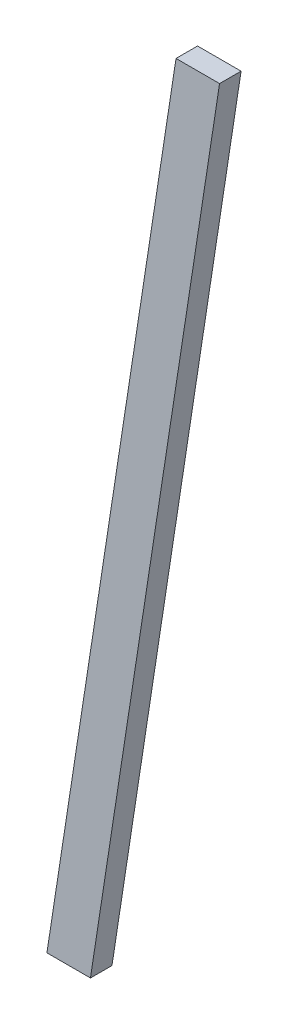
SolidWorks part; units mm, degrees
ref_plane "Front Plane" through (0, 0, 0) normal (0, 0, 1) x (1, 0, 0)
ref_plane "Top Plane" through (0, 0, 0) normal (0, 1, 0) x (1, 0, 0)
ref_plane "Right Plane" through (0, 0, 0) normal (1, 0, 0) x (0, 0, -1)
sketch "Sketch1" plane through (0, 0, 0) normal (0, 0, 1) x (1, 0, 0)
  line L0 (-1219.2, 0) -> (1219.2, 0) construction
  line L1 (0, 0) -> (0, 1981.2) construction
  line L2 (-914.4, 1981.2) -> (914.4, 1981.2) construction
  line L3 (-1219.2, 0) -> (-914.4, 1981.2)
  line L4 (-1219.2, 0) -> (-1219.2, 1981.2) construction
  line L5 (-1219.2, 990.6) -> (-1066.8, 990.6) construction
  line L6 (-1116.4047, 0) -> (-811.6047, 1981.2)
  line L7 (-914.4, 1981.2) -> (-811.6047, 1981.2)
  line L8 (-1118.7814, -15.449) -> (-813.9814, 1965.751) construction
  line L9 (-1219.2, 0) -> (-1116.4047, 0)
  point P3 (0, 0)
  point P9 (0, 1981.2)
  dimension "D1" = 2438.4
  dimension "D2" = 1981.2
  dimension "D3" = 1828.8
  dimension "D4" = 101.6
extrude "Boss-Extrude1" add sketch "Sketch1" along normal blind 50.8
